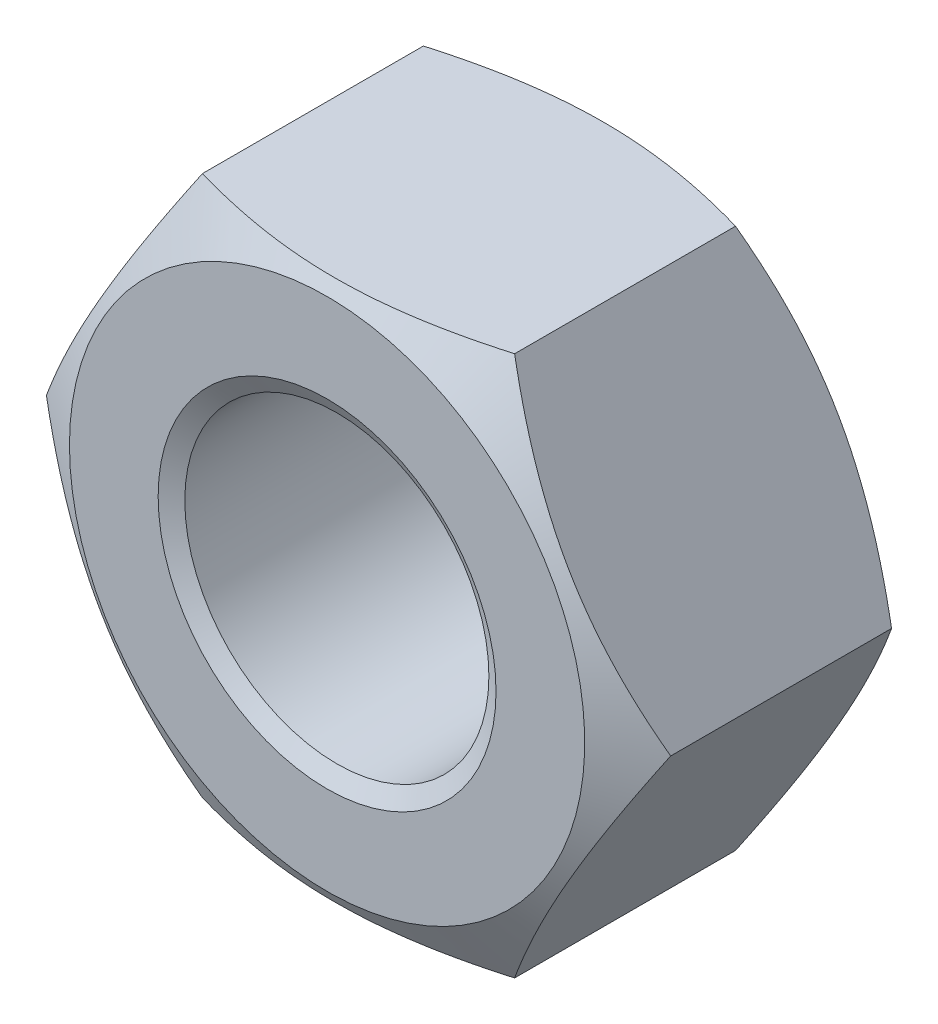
SolidWorks part; units mm, degrees
ref_plane "Front" through (0, 0, 0) normal (0, 0, 1) x (1, 0, 0)
ref_plane "Top" through (0, 0, 0) normal (0, 1, 0) x (1, 0, 0)
ref_plane "Right" through (0, 0, 0) normal (1, 0, 0) x (0, 0, -1)
sketch "Sketch1" plane through (0, 0, 0) normal (0, 0, 1) x (1, 0, 0)
  line L1 (9.2376, 0) -> (4.6188, 8)
  line L2 (4.6188, 8) -> (-4.6188, 8)
  line L3 (-4.6188, 8) -> (-9.2376, 0)
  line L4 (-9.2376, 0) -> (-4.6188, -8)
  line L5 (-4.6188, -8) -> (4.6188, -8)
  line L6 (4.6188, -8) -> (9.2376, 0)
  circle A0 centre (0, 0) radius 8 construction
  circle A1 centre (0, 0) radius 4.5
  dimension "D" = 9
  dimension "s" = 16
extrude "BaseNut" add sketch "Sketch1" against normal blind 8.4
sketch "Sketch2" plane through (0, 0, 0) normal (0, 1, 0) x (1, 0, 0)
  line L0 (-9.2376, 8.4) -> (-7.625, 8.4)
  line L2 (-7.625, 8.4) -> (-9.2376, 7.469)
  line L3 (-9.2376, 7.469) -> (-9.2376, 8.4)
  line L4 (0, 3.3759) -> (0, -9.8171) construction
  line L6 (-9.7712, 4.2) -> (9.8853, 4.2) construction
  line L7 (-9.2376, 0.931) -> (-9.2376, 0)
  line L8 (-7.625, 0) -> (-9.2376, 0.931)
  line L9 (-9.2376, 0) -> (-7.625, 0)
  dimension "D1" = 30
  dimension "dw" = 15.25
  dimension "D2" = 4.2
revolve "Double-Chamfer" cut sketch "Sketch2" angle 360 about L4
chamfer "EndChamfer" distance 0.5 angle 30 2 edges at (4.5, 0, -8.4) (4.5, 0, 0)
sketch "Sketch3" plane through (0, 0, 0) normal (0, 1, 0) x (1, 0, 0)
  line L0 (-4.933, 7.9) -> (-4.5, 7.65)
  line L1 (-4.5, 7.65) -> (-4, 7.65)
  line L2 (-4, 7.65) -> (-4, 8.15)
  line L3 (-4, 8.15) -> (-4.5, 8.15)
  line L4 (-4.5, 8.15) -> (-4.933, 7.9)
  line L5 (0, 7.4383) -> (0, 16.8806) construction
  dimension "D1" = 0.5
  dimension "D2" = 9
revolve "Cut-Revolve10" [suppressed] cut sketch "Sketch3" angle 360 about L5
pattern_linear "LPattern10" [suppressed] count 14 spacing 0.6 along (0, 0, -1)
equation "\"dw@Sketch2\" = \"s@Sketch1\"-0.75"
equation "\"D2@Sketch2\" = \"m@BaseNut\" / 2"
equation "\"D2@Sketch3\" = \"D@Sketch1\""
equation "\"D1@Sketch3\" =  (\"D@ThreadCosmetic1\"   - \"D@Sketch1\")  / 2"
equation "\"D3@LPattern10\" = \"D1@Sketch3\" * 1.2"
equation "\"D1@LPattern10\" = \"m@BaseNut\"/\"D3@LPattern10\""
